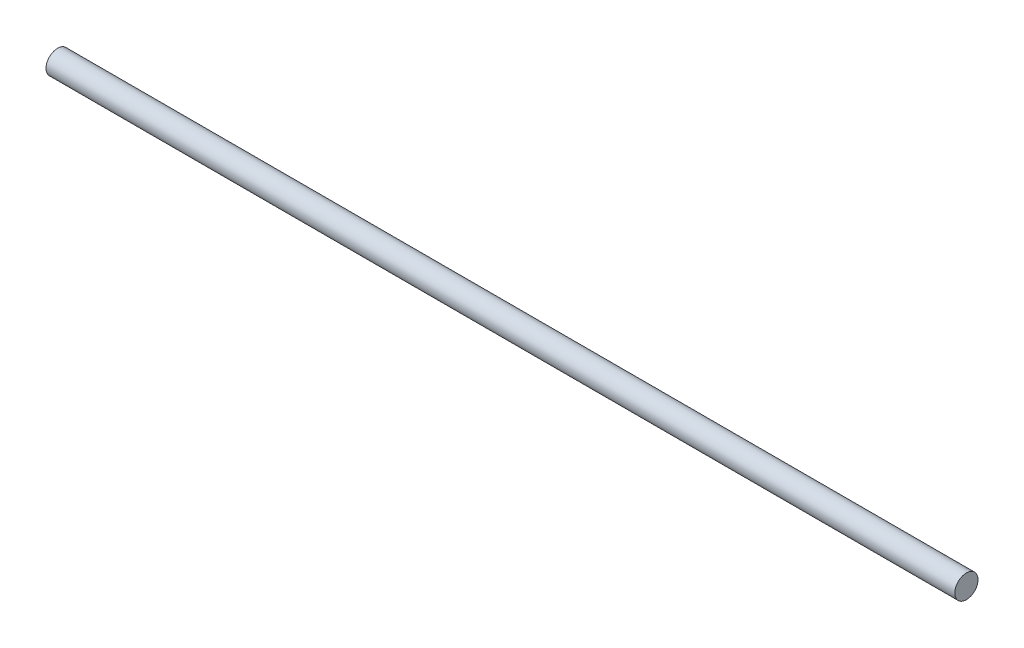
SolidWorks part; units mm, degrees
ref_plane "Front Plane" through (0, 0, 0) normal (0, 0, 1) x (1, 0, 0)
ref_plane "Top Plane" through (0, 0, 0) normal (0, 1, 0) x (1, 0, 0)
ref_plane "Right Plane" through (0, 0, 0) normal (1, 0, 0) x (0, 0, -1)
sketch "Sketch1" plane through (0, 0, 0) normal (0, 0, 1) x (1, 0, 0)
  line L0 (0, 0) -> (0, 3.9751)
  line L1 (0, 3.9751) -> (311.15, 3.9751)
  line L2 (311.15, 3.9751) -> (311.15, 0)
  line L3 (311.15, 0) -> (0, 0)
  line L4 (311.15, 0) -> (0, 0) construction
revolve "Revolve1" add sketch "Sketch1" angle 360 about L4
ref_plane "Plane1" through (295.275, 0, 0) normal (1, 0, 0) x (0, 0, -1)
ref_plane "Plane2" through (311.15, 0, 0) normal (1, 0, 0) x (0, 0, -1)
